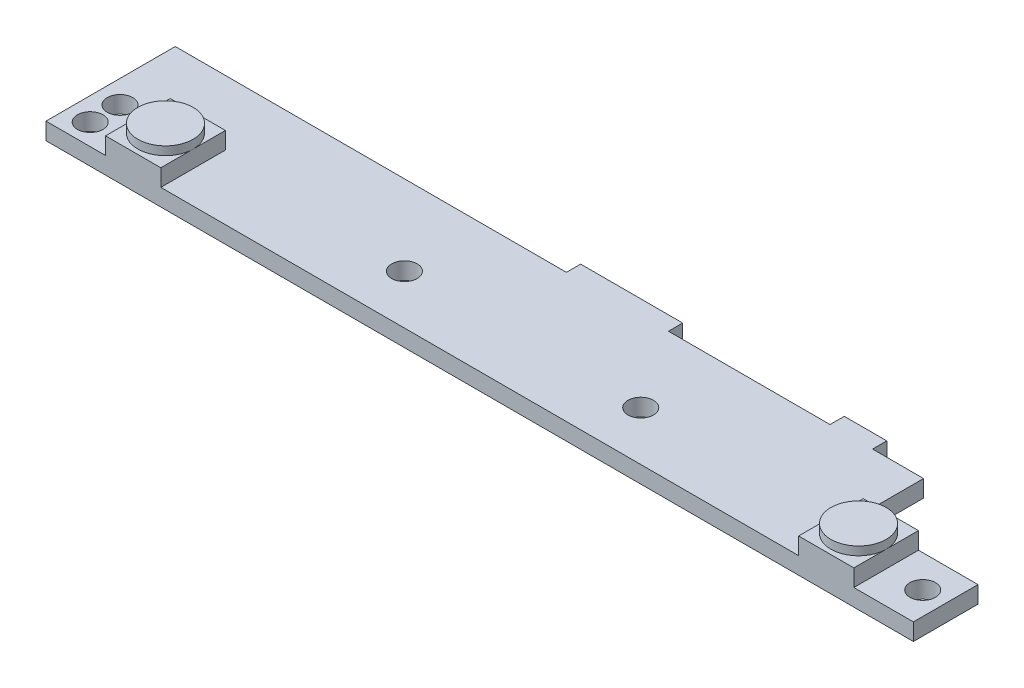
SolidWorks part; units mm, degrees
ref_plane "Front Plane" through (0, 0, 0) normal (0, 0, 1) x (1, 0, 0)
ref_plane "Top Plane" through (0, 0, 0) normal (0, 1, 0) x (1, 0, 0)
ref_plane "Right Plane" through (0, 0, 0) normal (1, 0, 0) x (0, 0, -1)
ref_plane "Plane1" through (0, 0, 0) normal (0, -1, 0) x (1, 0, 0)
sketch "Sketch1" plane through (0, 0, 0) normal (0, -1, 0) x (1, 0, 0)
  line L0 (-51, 7.6) -> (-51, 0)
  line L1 (-51, 0) -> (51, 0)
  line L2 (51, 0) -> (51, 7.6)
  line L3 (51, 7.6) -> (-51, 7.6)
extrude "Boss-Extrude1" add sketch "Sketch1" against normal blind 4
sketch "Sketch2" plane through (0, 0, 7.6) normal (0, 0, 1) x (1, 0, 0)
  line L0 (-51, 2) -> (37.5, 2)
  line L1 (37.5, 2) -> (37.5, 4)
  line L2 (37.5, 4) -> (-51, 4)
  line L3 (-51, 4) -> (-51, 2)
extrude "Cut-Extrude1" cut sketch "Sketch2" against normal through all
sketch "Sketch3" plane through (0, 0, 0) normal (0, 0, -1) x (-1, 0, 0)
  line L0 (-37, 2) -> (51, 2)
  line L1 (51, 2) -> (51, 0)
  line L2 (51, 0) -> (-37, 0)
  line L3 (-37, 0) -> (-37, 2)
extrude "Boss-Extrude2" add sketch "Sketch3" along normal blind 9.2731
sketch "Sketch4" plane through (0, 2, 0) normal (0, 1, 0) x (-1, 0, 0)
  line L0 (-26, -9.2731) -> (-7, -9.2731)
  line L1 (-7, -9.2731) -> (-7, -7.6)
  line L2 (-7, -7.6) -> (-26, -7.6)
  line L3 (-26, -7.6) -> (-26, -9.2731)
extrude "Cut-Extrude2" cut sketch "Sketch4" against normal through all
sketch "Sketch5" plane through (0, 2, 0) normal (0, 1, 0) x (-1, 0, 0)
  line L0 (-31, -9.2731) -> (-31, -7.6)
  line L1 (-31, -7.6) -> (-37, -7.6)
  line L2 (-37, -7.6) -> (-37, -9.2731)
  line L3 (-37, -9.2731) -> (-31, -9.2731)
extrude "Cut-Extrude3" cut sketch "Sketch5" against normal through all
sketch "Sketch6" plane through (0, 0, 0) normal (0, -1, 0) x (1, 0, 0)
  line L0 (-51, -9.2731) -> (-5, -9.2731)
  line L1 (-5, -9.2731) -> (-5, -7.6)
  line L2 (-5, -7.6) -> (-51, -7.6)
  line L3 (-51, -7.6) -> (-51, -9.2731)
extrude "Cut-Extrude4" cut sketch "Sketch6" against normal through all
sketch "Sketch7" plane through (0, 0, 7.6) normal (0, 0, 1) x (1, 0, 0)
  line L0 (44, 4) -> (44, 2)
  line L1 (44, 2) -> (51, 2)
  line L2 (51, 2) -> (51, 4)
  line L3 (51, 4) -> (44, 4)
extrude "Cut-Extrude5" cut sketch "Sketch7" against normal through all
sketch "Sketch8" plane through (0, 2, 0) normal (0, 1, 0) x (-1, 0, 0)
  line L0 (37.5, 7.6) -> (44, 7.6)
  line L1 (44, 7.6) -> (44, 0)
  line L2 (44, 0) -> (37.5, 0)
  line L3 (37.5, 0) -> (37.5, 7.6)
extrude "Boss-Extrude3" add sketch "Sketch8" along normal blind 2
ref_plane "Plane2" through (0, 0, 3.8) normal (0, 0, -1) x (-1, 0, 0)
sketch "Sketch9" plane through (0, 0, 3.8) normal (0, 0, -1) x (-1, 0, 0)
  line L0 (37.5, 4) -> (40.75, 4)
  line L1 (40.75, 4) -> (40.75, 5)
  line L2 (40.75, 5) -> (37.5, 5)
  line L3 (37.5, 5) -> (37.5, 4)
  line L4 (40.75, 4) -> (40.75, 5) construction
revolve "Revolve1" add sketch "Sketch9" angle 360 about L4
sketch "Sketch10" plane through (0, 0, 3.8) normal (0, 0, -1) x (-1, 0, 0)
  line L0 (-44, 4) -> (-40.75, 4)
  line L1 (-40.75, 4) -> (-40.75, 5)
  line L2 (-40.75, 5) -> (-44, 5)
  line L3 (-44, 5) -> (-44, 4)
  line L4 (-40.75, 4) -> (-40.75, 5) construction
revolve "Revolve2" add sketch "Sketch10" angle 360 about L4
hole_wizard "Ø3.0 (3) Diameter Hole1" positions "Sketch12" profile "Sketch11" hole size "Ø3.0" standard "ANSI Metric"
sketch "Sketch12" plane through (0, 0, 0) normal (0, -1, 0) x (-1, 0, 0)
  point P0 (48.3, -5.1)
  point P1 (-13.1495, -1.8103)
  point P2 (-48.3, -3.8)
  point P3 (48.3, -1.6)
  point P4 (14.6391, -1.8103)
sketch "Sketch11" plane through (-48.3, 0, 5.1) normal (1, 0, 0) x (0, 0, -1)
  line L0 (0, 0) -> (0, 5)
  line L1 (0, 5) -> (1.5, 5)
  line L2 (1.5, 5) -> (1.5, 0)
  line L5 (1.5, 0) -> (0, 0)
  line L11 (0, -6.35) -> (0, 107.95) construction
  dimension "Thru Hole Dia." = 3
  dimension "Thru Hole Depth" = 5
